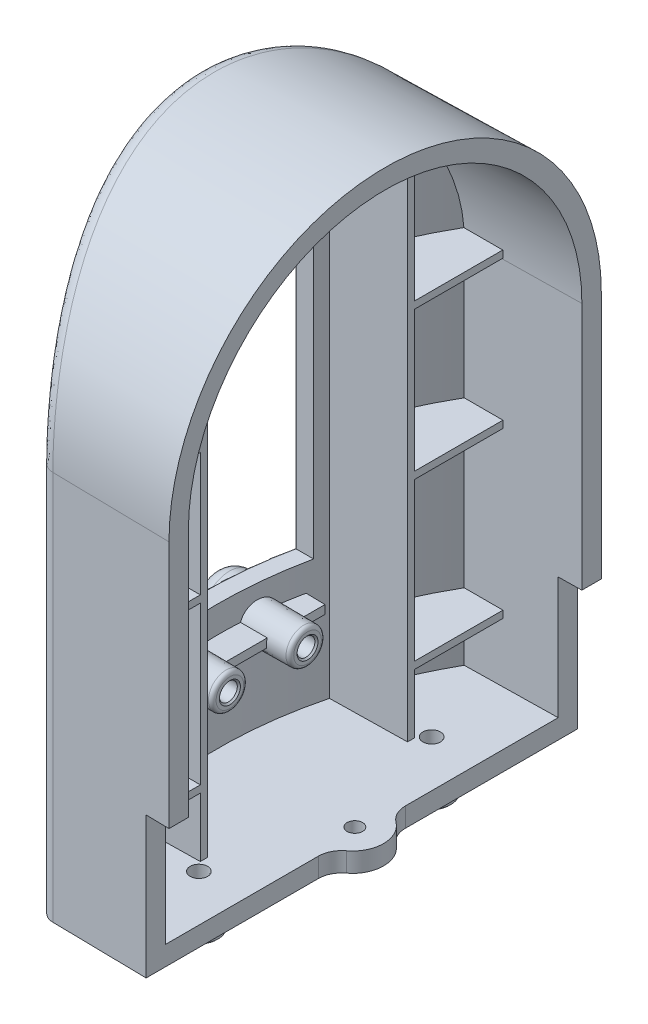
SolidWorks part; units mm, degrees
other "Solido1"
ref_plane "前视基准面" through (0, 0, 0) normal (0, 0, 1) x (1, 0, 0)
ref_plane "上视基准面" through (0, 0, 0) normal (0, 1, 0) x (1, 0, 0)
ref_plane "右视基准面" through (0, 0, 0) normal (1, 0, 0) x (0, 0, -1)
imported_body "Surface-Imported1"
imported_body "Imported1"
other "移动面1" parameters "D1"=0.15
other "移动面6" parameters "D1"=0.15
fillet "Fillet1" radius 0.5 4 edges at (-44.5, 36.45, 7.2738) (-44.5, 36.45, -2.7262) (-44.5, 86.75, 7.2738) (-44.5, 86.75, -2.7262)
